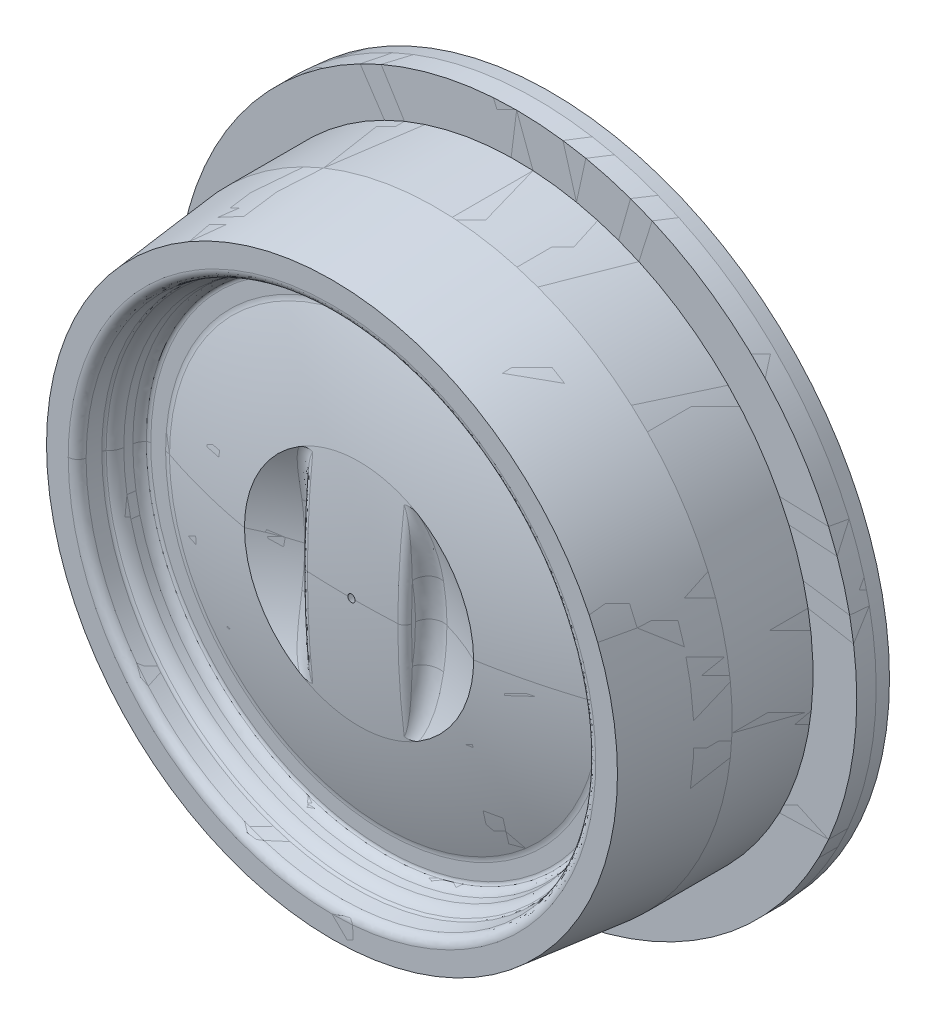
SolidWorks part; units mm, degrees
ref_plane "Plan de face" through (0, 0, 0) normal (0, 0, 1) x (1, 0, 0)
ref_plane "Plan de dessus" through (0, 0, 0) normal (0, 1, 0) x (1, 0, 0)
ref_plane "Plan de droite" through (0, 0, 0) normal (1, 0, 0) x (0, 0, -1)
imported_body "Importée1"
ref_plane "Plan1" through (0, 0, -36.906) normal (0, 0, -1) x (-1, 0, 0)
sketch "Esquisse1" plane through (0, 0, -36.906) normal (0, 0, -1) x (-1, 0, 0)
  line L2 (29.5, -2) -> (38.5, -2)
  line L3 (38.5, 2) -> (29.5, 2)
  line L4 (29.5, -2) -> (38.5, -2)
  line L5 (38.5, 2) -> (29.5, 2)
  arc A2 (29.5, 2) -> (29.5, -2) centre (29.5, 0) ccw
  arc A3 (38.5, -2) -> (38.5, 2) centre (38.5, 0) ccw
  arc A4 (29.5, 2) -> (29.5, -2) centre (29.5, 0) ccw
  arc A5 (38.5, -2) -> (38.5, 2) centre (38.5, 0) ccw
  dimension "D1" = 0
extrude "Enlèv. mat.-Extru.3" cut sketch "Esquisse1" along normal through all
hole_wizard "Diamètre du perçage M12.0 (12,000000)1" positions "Esquisse4" profile "Esquisse3" hole size "M12.0" standard "ISO"
sketch "Esquisse4" plane through (0, 0, -41.006) normal (0, 0, -1) x (-1, 0, 0)
  point P0 (29.445, 17)
  point P4 (0.0001, 34.0001)
  point P7 (-29.4449, 17.0001)
  point P10 (-29.445, -17)
  point P13 (-0.0001, -34.0001)
  point P16 (29.4449, -17.0001)
sketch "Esquisse3" plane through (-29.445, 17, -41.006) normal (1, 0, 0) x (0, 1, 0)
  line L0 (0, 0) -> (0, 23.1452)
  line L1 (0, 23.1452) -> (6, 19.54)
  line L2 (6, 19.54) -> (6, 0)
  line L5 (6, 0) -> (0, 0)
  line L10 (0, 23.1452) -> (-6, 19.54) construction
  line L11 (0, -6.35) -> (0, 107.95) construction
  dimension "Diamètre du perçage" = 12
  dimension "Profondeur du perçage" = 19.54
  dimension "Angle de pointe" = 118
hole_wizard "Diamètre du perçage M4.9 (4,900000)1" positions "Esquisse7" profile "Esquisse6" hole size "M4.9" standard "ISO"
sketch "Esquisse7" plane through (0, 0, -46.006) normal (0, 0, -1) x (-1, 0, 0)
  point P0 (-38, 38)
  point P6 (38, 38)
  point P9 (38, -38)
  point P12 (-38, -38)
sketch "Esquisse6" plane through (38, 38, -46.006) normal (1, 0, 0) x (0, 1, 0)
  line L0 (0, 0) -> (0, 21.4871)
  line L1 (0, 21.4871) -> (2.475, 20)
  line L2 (2.475, 20) -> (2.475, 0)
  line L5 (2.475, 0) -> (0, 0)
  line L10 (0, 21.4871) -> (-2.475, 20) construction
  line L11 (0, -6.35) -> (0, 107.95) construction
  dimension "Diamètre du perçage" = 4.95
  dimension "Profondeur du perçage" = 20
  dimension "Angle de pointe" = 118
sketch "Esquisse8" plane through (0, 0, -46.006) normal (0, 0, -1) x (-1, 0, 0)
  line L0 (74.1451, 0) -> (0, 0)
  line L1 (0, 0) -> (0, -74.1451)
  arc A1 (74.1451, 0) -> (0, -74.1451) centre (0, 0) cw
extrude "Mask" cut sketch "Esquisse8" against normal mid plane 90
sketch "Esquisse9" plane through (0, 0, -46.006) normal (0, 0, -1) x (-1, 0, 0)
  line L0 (0, -75) -> (0, 75)
  arc A0 (0, 75) -> (0, -75) centre (0, 0) ccw
extrude "Enlèv. mat.-Extru.4" cut sketch "Esquisse9" against normal mid plane 96
sketch "Esquisse10" plane through (0, 0, 0) normal (1, 0, 0) x (0, 0, -1)
  line L24 (12.072, 48.3635) -> (12.072, 45.3115)
  line L25 (5.0166, 0.751) -> (6.4848, 1.284)
  line L26 (7.9554, 1.999) -> (58.9176, 3.7862)
  line L27 (60.826, 5.4922) -> (60.826, 12)
  line L28 (61.826, 13) -> (66.006, 13)
  line L29 (66.006, 13) -> (66.006, 20)
  line L30 (66.006, 20) -> (46.006, 20)
  line L31 (46.006, 20) -> (46.006, 28)
  line L32 (46.006, 28) -> (41.006, 28)
  line L33 (41.006, 28) -> (41.006, 28.0001)
  line L34 (41.006, 28.0001) -> (21.47, 28.0001)
  line L35 (21.47, 28.0001) -> (21.466, 28.0001)
  line L36 (21.466, 40.0001) -> (21.47, 40.0001)
  line L37 (21.47, 40.0001) -> (41.006, 40.0001)
  line L38 (41.006, 40.0001) -> (46.006, 40)
  line L39 (46.006, 40) -> (46.006, 69.7375)
  line L40 (46.006, 69.7375) -> (43.006, 70)
  line L41 (43.006, 70) -> (39.006, 70)
  line L42 (39.006, 70) -> (39.006, 61)
  line L43 (39.006, 61) -> (22.3753, 61)
  line L44 (22.3753, 61) -> (1.006, 58.754)
  line L45 (1.006, 58.754) -> (1.006, 54.2815)
  line L46 (2.7033, 52.2947) -> (5.4887, 51.8535)
  line L47 (8.4245, 50.2681) -> (10.0291, 50.014)
  line L48 (12.072, 48.3635) -> (12.072, 45.3115)
  line L49 (5.0166, 0.751) -> (6.4848, 1.284)
  line L50 (7.9554, 1.999) -> (58.9176, 3.7862)
  line L51 (60.826, 5.4922) -> (60.826, 12)
  line L52 (61.826, 13) -> (66.006, 13)
  line L53 (66.006, 13) -> (66.006, 20)
  line L54 (66.006, 20) -> (46.006, 20)
  line L55 (46.006, 20) -> (46.006, 28)
  line L56 (46.006, 28) -> (41.006, 28)
  line L57 (41.006, 28) -> (41.006, 28.0001)
  line L58 (41.006, 28.0001) -> (21.47, 28.0001)
  line L59 (21.47, 28.0001) -> (21.466, 28.0001)
  line L60 (21.466, 40.0001) -> (21.47, 40.0001)
  line L61 (21.47, 40.0001) -> (41.006, 40.0001)
  line L62 (41.006, 40.0001) -> (46.006, 40)
  line L63 (46.006, 40) -> (46.006, 69.7375)
  line L64 (46.006, 69.7375) -> (43.006, 70)
  line L65 (43.006, 70) -> (39.006, 70)
  line L66 (39.006, 70) -> (39.006, 61)
  line L67 (39.006, 61) -> (22.3753, 61)
  line L68 (22.3753, 61) -> (1.006, 58.754)
  line L69 (1.006, 58.754) -> (1.006, 54.2815)
  line L70 (2.7033, 52.2947) -> (5.4887, 51.8535)
  line L71 (8.4245, 50.2681) -> (10.0291, 50.014)
  arc A2 (58.9176, 3.7862) -> (60.826, 5.4922) centre (58.8476, 5.785) ccw
  arc A3 (61.826, 13) -> (60.826, 12) centre (61.826, 12) ccw
  arc A4 (58.9176, 3.7862) -> (60.826, 5.4922) centre (58.8476, 5.785) ccw
  arc A5 (61.826, 13) -> (60.826, 12) centre (61.826, 12) ccw
  spline S10 degree 2 poles (12.072, 45.3115) (12.0719, 44.8092) (11.9092, 44.3339) knots 0 0 0 0.999946 0.999946 0.999946 weights 0.99999 0.986424 1
  spline S11 degree 4 poles (11.9092, 44.3339) (10.1715, 39.2607) (8.6989, 34.0966) (7.4986, 28.8626) (6.5743, 23.5803) knots 2.298493 2.298493 2.298493 2.298493 2.298493 23.620878 23.620878 23.620878 23.620878 23.620878 weights 1 1 1 1 1
  spline S12 degree 3 poles (6.5743, 23.5803) (6.0717, 19.7964) (5.6906, 16.0003) (5.1708, 8.384) (5.0326, 4.568) (5.0166, 0.751) knots 0 0 0 0 0.5 0.5 1 1 1 1
  spline S13 degree 3 poles (6.4848, 1.284) (6.6643, 1.4983) (6.8914, 1.6759) (7.2692, 1.8597) (7.4037, 1.9084) (7.6756, 1.9754) (7.8142, 1.9946) (7.9554, 1.999) knots 0 0 0 0 0.5 0.5 0.75 0.75 1 1 1 1
  spline S14 degree 3 number of poles 88 (21.466, 28.0001) -> (21.466, 40.0001)
  spline S15 degree 2 poles (1.006, 54.2815) (1.0064, 52.5634) (2.7033, 52.2947) knots 0 0 0 3.417843 3.417843 3.417843 weights 0.999917 0.760448 1
  spline S16 degree 2 poles (5.4887, 51.8535) (5.838, 51.7982) (6.0759, 51.5364) knots 0 0 0 0.703366 0.703366 0.703366 weights 1 0.943398 1
  spline S17 degree 4 poles (6.0759, 51.5364) (6.5333, 51.033) (7.1045, 50.6325) (7.7527, 50.3745) (8.4245, 50.2681) knots 0.124187 0.124187 0.124187 0.124187 0.124187 2.828736 2.828736 2.828736 2.828736 2.828736 weights 1 1 1 1 1
  spline S18 degree 4 poles (10.0291, 50.014) (10.5441, 49.9324) (11.0405, 49.7321) (11.4757, 49.4204) (11.8205, 49.0293) knots 0.107483 0.107483 0.107483 0.107483 0.107483 2.180458 2.180458 2.180458 2.180458 2.180458 weights 1 1 1 1 1
  spline S19 degree 2 poles (11.8205, 49.0293) (12.072, 48.7442) (12.072, 48.364) (12.072, 48.3638) (12.072, 48.3635) knots 0 0 0 0.756643 0.756643 0.757074 0.757074 0.757074 weights 1 0.935414 1 1 1
  spline S20 degree 2 poles (12.072, 45.3115) (12.0719, 44.8092) (11.9092, 44.3339) knots 0 0 0 0.999946 0.999946 0.999946 weights 0.99999 0.986424 1
  spline S21 degree 4 poles (11.9092, 44.3339) (10.1715, 39.2607) (8.6989, 34.0966) (7.4986, 28.8626) (6.5743, 23.5803) knots 2.298493 2.298493 2.298493 2.298493 2.298493 23.620878 23.620878 23.620878 23.620878 23.620878 weights 1 1 1 1 1
  spline S22 degree 3 poles (6.5743, 23.5803) (6.0717, 19.7964) (5.6906, 16.0003) (5.1708, 8.384) (5.0326, 4.568) (5.0166, 0.751) knots 0 0 0 0 0.5 0.5 1 1 1 1
  spline S23 degree 3 poles (6.4848, 1.284) (6.6643, 1.4983) (6.8914, 1.6759) (7.2692, 1.8597) (7.4037, 1.9084) (7.6756, 1.9754) (7.8142, 1.9946) (7.9554, 1.999) knots 0 0 0 0 0.5 0.5 0.75 0.75 1 1 1 1
  spline S24 degree 3 number of poles 88 (21.466, 28.0001) -> (21.466, 40.0001)
  spline S25 degree 2 poles (1.006, 54.2815) (1.0064, 52.5634) (2.7033, 52.2947) knots 0 0 0 3.417843 3.417843 3.417843 weights 0.999917 0.760448 1
  spline S26 degree 2 poles (5.4887, 51.8535) (5.838, 51.7982) (6.0759, 51.5364) knots 0 0 0 0.703366 0.703366 0.703366 weights 1 0.943398 1
  spline S27 degree 4 poles (6.0759, 51.5364) (6.5333, 51.033) (7.1045, 50.6325) (7.7527, 50.3745) (8.4245, 50.2681) knots 0.124187 0.124187 0.124187 0.124187 0.124187 2.828736 2.828736 2.828736 2.828736 2.828736 weights 1 1 1 1 1
  spline S28 degree 4 poles (10.0291, 50.014) (10.5441, 49.9324) (11.0405, 49.7321) (11.4757, 49.4204) (11.8205, 49.0293) knots 0.107483 0.107483 0.107483 0.107483 0.107483 2.180458 2.180458 2.180458 2.180458 2.180458 weights 1 1 1 1 1
  spline S29 degree 2 poles (11.8205, 49.0293) (12.072, 48.7442) (12.072, 48.364) (12.072, 48.3638) (12.072, 48.3635) knots 0 0 0 0.756643 0.756643 0.757074 0.757074 0.757074 weights 1 0.935414 1 1 1
  dimension "D1" = 0
